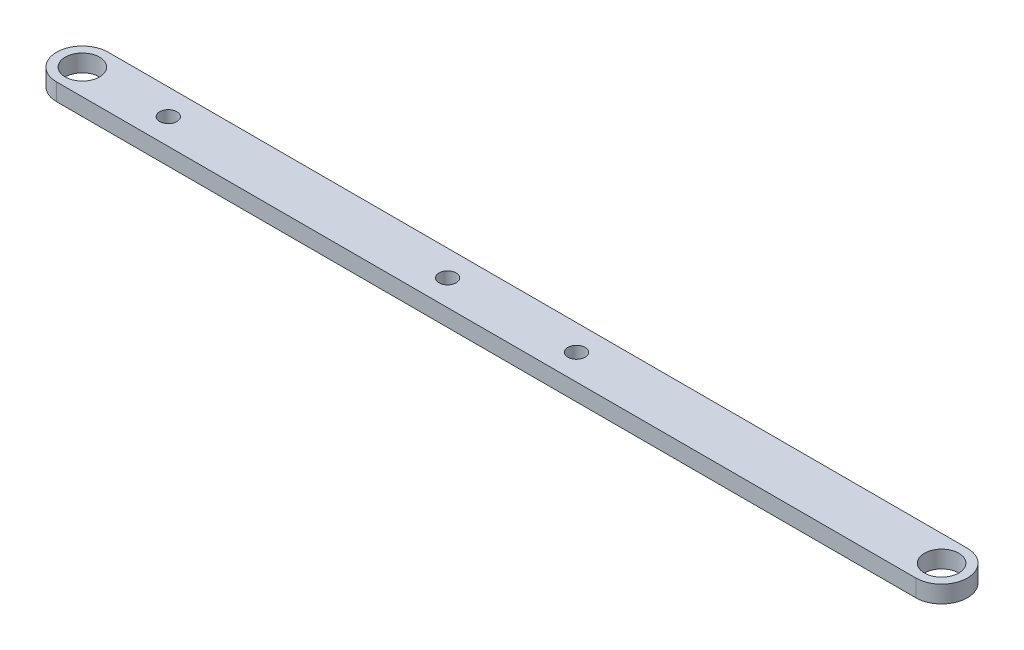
SolidWorks part; units mm, degrees
ref_plane "Front Plane" through (0, 0, 0) normal (0, 0, 1) x (1, 0, 0)
ref_plane "Top Plane" through (0, 0, 0) normal (0, 1, 0) x (1, 0, 0)
ref_plane "Right Plane" through (0, 0, 0) normal (1, 0, 0) x (0, 0, -1)
sketch "Sketch1" plane through (0, 0, 0) normal (0, 1, 0) x (1, 0, 0)
  line L0 (-50, 0) -> (50, 0) construction
  line L1 (-50, -3) -> (50, -3)
  line L2 (-50, 3) -> (50, 3)
  line L3 (-7.5, 0) -> (7.5, 0) construction
  arc A0 (-50, -3) -> (-50, 3) centre (-50, 0) cw
  arc A1 (50, -3) -> (50, 3) centre (50, 0) ccw
  circle A2 centre (-50, 0) radius 2
  circle A3 centre (50, 0) radius 2
  circle A4 centre (-7.5, 0) radius 1
  circle A5 centre (7.5, 0) radius 1
  point P2 (0, 0)
  point P12 (0, 0)
  dimension "D4" = 15
  dimension "Pin diameter" = 4
  dimension "Bolt diameter" = 2
  dimension "D1" = 100
  dimension "D2" = 3
  dimension "D3" = 3
extrude "Extrude1" add sketch "Sketch1" along normal blind 2
sketch "Sketch2" plane through (0, 2, 0) normal (0, 1, 0) x (1, 0, 0)
  circle A0 centre (-40, 0) radius 1
  circle A1 centre (-50, 0) radius 2 construction
  dimension "D1" = 2
  dimension "D2" = 10
extrude "Extrude2" cut sketch "Sketch2" against normal through all
